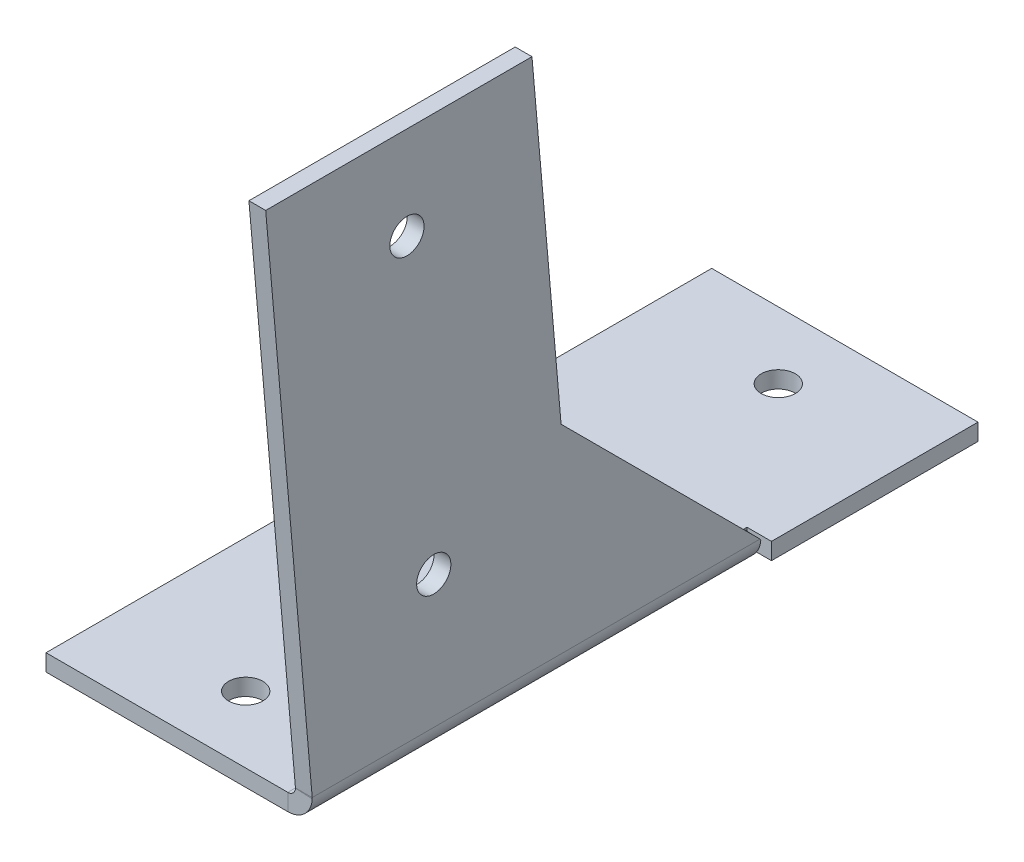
SolidWorks part; units mm, degrees
other "<Support-Bracket>-<Cut-Extrude2>"
ref_plane "Front Plane" through (0, 0, 0) normal (0, 0, 1) x (1, 0, 0)
ref_plane "Top Plane" through (0, 0, 0) normal (0, 1, 0) x (1, 0, 0)
ref_plane "Right Plane" through (0, 0, 0) normal (1, 0, 0) x (0, 0, -1)
mirrored part "Support-Bracket_Mirrored"
